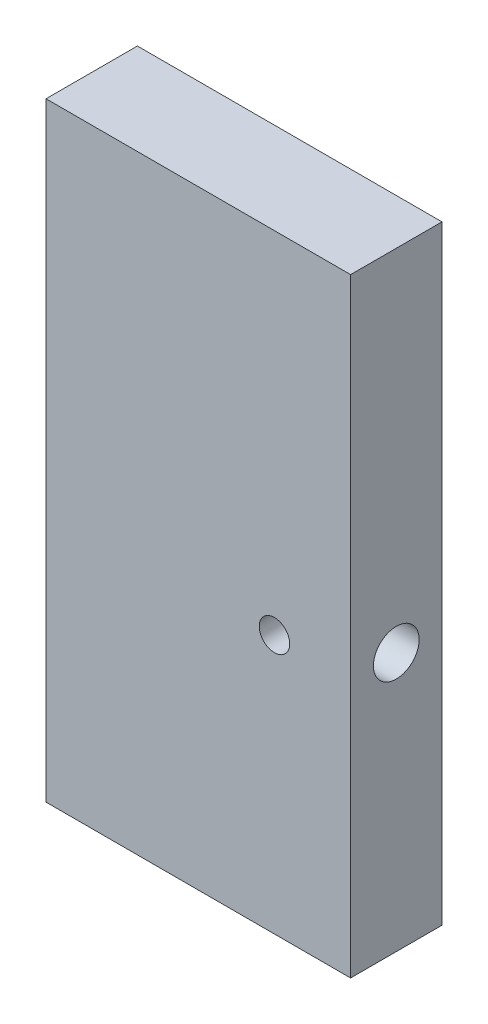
SolidWorks part; units mm, degrees
ref_plane "Face" through (0, 0, 0) normal (0, 0, 1) x (1, 0, 0)
ref_plane "Dessus" through (0, 0, 0) normal (0, 1, 0) x (1, 0, 0)
ref_plane "Droite" through (0, 0, 0) normal (1, 0, 0) x (0, 0, -1)
sketch "Esquisse1" plane through (0, 0, 0) normal (0, 0, 1) x (1, 0, 0)
  line L1 (-25.1689, 21.7017) -> (-5.1689, 21.7017)
  line L2 (-25.1689, 21.7017) -> (-25.1689, -18.2983)
  line L3 (-25.1689, -18.2983) -> (-5.1689, -18.2983)
  line L4 (-5.1689, 21.7017) -> (-5.1689, -18.2983)
  dimension "D1" = 20
  dimension "D2" = 40
extrude "Extrusion1" add sketch "Esquisse1" along normal blind 6
sketch "Esquisse2" plane through (-5.1689, 0, 0) normal (1, 0, 0) x (0, 0, -1)
  line L0 (-6, -1.2983) -> (0, -1.2983) construction
  line L4 (-6, -18.2983) -> (0, -18.2983) construction
  line L5 (-3, -18.2983) -> (-3, 21.7017) construction
  line L6 (-6, 21.7017) -> (0, 21.7017) construction
  circle A0 centre (-3, -1.2983) radius 1.5
  dimension "D1" = 3
  dimension "D2" = 17
extrude "Enlèv. mat.-Extru.1" cut sketch "Esquisse2" against normal blind 10
sketch "Esquisse3" plane through (0, 0, 6) normal (0, 0, 1) x (1, 0, 0)
  line L0 (-15.1689, -1.2983) -> (-5.1689, -1.2983) construction
  line L1 (-5.1689, -18.2983) -> (-5.1689, 21.7017) construction
  circle A0 centre (-10.1689, -1.2983) radius 1
  dimension "D1" = 5
extrude "Enlèv. mat.-Extru.2" cut sketch "Esquisse3" against normal blind 2
